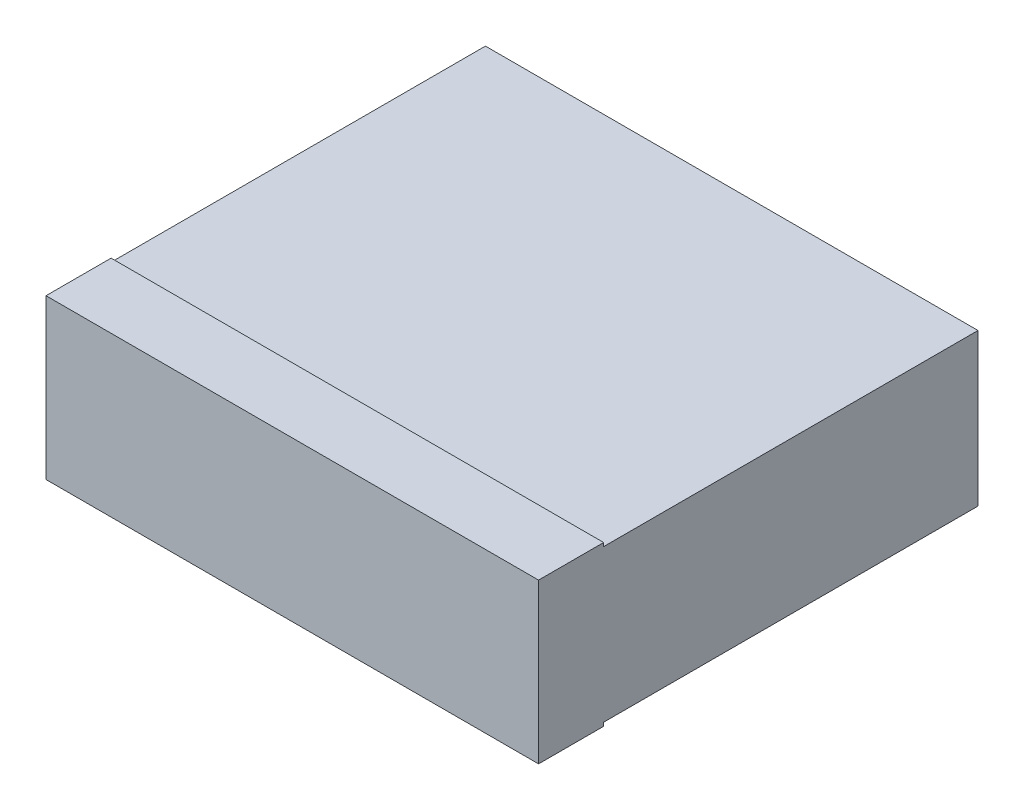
SolidWorks part; units mm, degrees
ref_plane "Front Plane" through (0, 0, 0) normal (0, 0, 1) x (1, 0, 0)
ref_plane "Top Plane" through (0, 0, 0) normal (0, 1, 0) x (1, 0, 0)
ref_plane "Right Plane" through (0, 0, 0) normal (1, 0, 0) x (0, 0, -1)
sketch "Sketch1" plane through (0, 0, 0) normal (0, 0, 1) x (1, 0, 0)
  line L1 (-79.375, -24.511) -> (79.375, -24.511)
  line L2 (-79.375, -24.511) -> (-79.375, 24.511)
  line L3 (-79.375, 24.511) -> (79.375, 24.511)
  line L4 (79.375, -24.511) -> (79.375, 24.511)
  line L5 (-79.375, -24.511) -> (79.375, 24.511) construction
  line L6 (-79.375, 24.511) -> (79.375, -24.511) construction
  point P0 (0, 0)
extrude "Boss-Extrude1" add sketch "Sketch1" along normal blind 120.65 contours L2 L1 L4 L3
sketch "Sketch2" plane through (0, 0, 120.65) normal (0, 0, 1) x (1, 0, 0)
  line L1 (-79.375, -25.654) -> (79.375, -25.654)
  line L2 (-79.375, -25.654) -> (-79.375, 25.654)
  line L3 (-79.375, 25.654) -> (79.375, 25.654)
  line L4 (79.375, -25.654) -> (79.375, 25.654)
  line L5 (-79.375, -25.654) -> (79.375, 25.654) construction
  line L6 (-79.375, 25.654) -> (79.375, -25.654) construction
  point P0 (0, 0)
extrude "Boss-Extrude2" add sketch "Sketch2" along normal blind 20.9804
sketch "Sketch3" plane through (0, 0, 141.6304) normal (0, 0, 1) x (1, 0, 0)
  line L0 (59.8583, 110.7207) -> (616.525, 110.7207) construction
